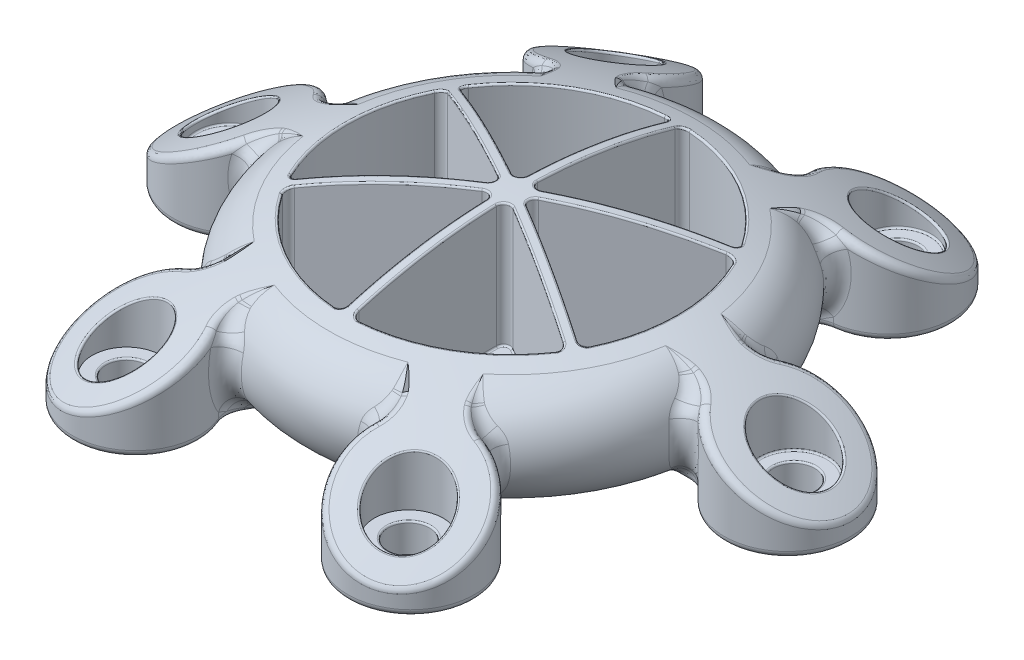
SolidWorks part; units mm, degrees
ref_plane "Front" through (0, 0, 0) normal (0, 0, 1) x (1, 0, 0)
ref_plane "Top" through (0, 0, 0) normal (0, 1, 0) x (1, 0, 0)
ref_plane "Right" through (0, 0, 0) normal (1, 0, 0) x (0, 0, -1)
sketch "Sketch2" plane through (0, 0, 0) normal (0, 0, 1) x (1, 0, 0)
  line L0 (0, 0) -> (0, 53.3463) construction
  line L1 (0, 0) -> (38.1, 0)
  line L2 (0, 31.75) -> (0, 0)
  arc A0 (38.1, 0) -> (42.2745, 24.6943) centre (38.1, 12.7) ccw
  arc A1 (42.2745, 24.6943) -> (0, 31.75) centre (0.5297, -95.2489) ccw
  dimension "D1" = 12.7
  dimension "D2" = 127
  dimension "D3" = 31.75
  dimension "D4" = 50.8
revolve "Revolve1" add sketch "Sketch2" angle 360 about L0
sketch "Sketch3" plane through (0, 0, 0) normal (0, 1, 0) x (1, 0, 0)
  line L0 (0, 0) -> (88.9723, 0) construction
  line L1 (37.5671, 6.35) -> (46.832, 6.35)
  line L2 (37.5671, -6.35) -> (46.832, -6.35)
  arc A0 (37.5671, 6.35) -> (37.5671, -6.35) centre (0, 0) cw
  circle A1 centre (0, 0) radius 38.1 construction
  circle A2 centre (0, 0) radius 42.2745 construction
  arc A3 (46.832, 6.35) -> (51.8829, 8.8515) centre (46.832, 12.7) ccw
  arc A4 (46.832, -6.35) -> (51.8829, -8.8515) centre (46.832, -12.7) cw
  arc A5 (51.8829, 8.8515) -> (51.8829, -8.8515) centre (63.5, 0) cw
  dimension "D3" = 14.605
  dimension "D4" = 6.35
  dimension "D5" = 6.35
  dimension "D1" = 12.7
  dimension "D2" = 63.5
extrude "Extrude1" add sketch "Sketch3" along normal up to surface (22.841 mm away)
sketch "Sketch5" plane through (0, 0, 0) normal (0, 0, 1) x (1, 0, 0)
  line L0 (64.994, -1.016) -> (64.994, 26.0198) construction
  line L2 (64.994, -1.016) -> (64.994, 19.304)
  line L3 (64.994, 19.304) -> (57.0565, 19.304)
  line L4 (57.0565, 19.304) -> (57.0565, 6.604)
  line L5 (57.0565, 6.604) -> (60.2315, 6.604)
  line L6 (60.2315, 6.604) -> (60.2315, -1.016)
  line L7 (60.2315, -1.016) -> (64.994, -1.016)
  line L8 (51.8829, 0) -> (78.105, 0) construction
  dimension "D1" = 20.32
  dimension "D2" = 12.7
  dimension "D3" = 9.525
  dimension "D4" = 15.875
  dimension "D5" = 64.994
  dimension "D6" = 1.016
revolve "Cut-Revolve1" cut sketch "Sketch5" angle 360 about L0
pattern_circular "CirPattern1" count 6 over 360 about axis through (0, 0, 0) along (0, 1, 0) of "Cut-Revolve1", "Extrude1"
ref_plane "Plane1" through (0, 33.02, 0) normal (0, 1, 0) x (-1, 0, 0)
sketch "Sketch6" plane through (0, 33.02, 0) normal (0, 1, 0) x (1, 0, 0)
  line L0 (0, 0) -> (0, 64.5956) construction
  line L1 (0, 0) -> (88.3128, 0) construction
  line L2 (4.6863, 1.3858) -> (32.0919, 17.2084)
  line L3 (4.6863, -1.3858) -> (32.0919, -17.2084)
  arc A0 (37.5671, 6.35) -> (24.2828, 29.3591) centre (0, 0) ccw construction
  arc A2 (34.334, 16.5163) -> (34.334, -16.5163) centre (0, 0) cw
  arc A3 (4.6863, 1.3858) -> (4.6863, -1.3858) centre (5.4864, 0) ccw
  arc A4 (32.0919, -17.2084) -> (34.334, -16.5163) centre (32.892, -15.8226) ccw
  arc A5 (32.0919, 17.2084) -> (34.334, 16.5163) centre (32.892, 15.8226) cw
  point P13 (2.286, 0)
  point P16 (33.5522, -18.0516)
  point P19 (33.5522, 18.0516)
  dimension "D1" = 38.1
  dimension "D4" = 1.6002
  dimension "D5" = 1.6002
  dimension "D2" = 60
  dimension "D3" = 4.572
extrude "Cut-Extrude1" cut sketch "Sketch6" against normal offset from surface (29.845 mm away) 3.175
pattern_circular "CirPattern2" count 6 over 360 about axis through (0, 0, 0) along (0, 1, 0) of "Cut-Extrude1"
fillet "Fillet1" radius 1.5875 60 edges at (-15.4283, 0.7266, -39.4227) (-15.6005, 0, -39.7209) (-18.7546, 0, -46.5032) (-18.6861, 21.908, -45.8946) (-26.599, 0, -33.3709) (-31.4566, 21.3993, -39.8267) (-30.8956, 0, -39.4935) (26.4269, 0.7266, -33.0727) (26.599, 0, -33.3709) (30.8956, 0, -39.4935) (30.4028, 21.908, -39.13) (15.6005, 0, -39.7209) (18.7626, 21.3993, -47.1556) (18.7546, 0, -46.5032) (42.1996, 0, 6.35) (49.6502, 0, 7.0096) (42.1996, 0, -6.35) (49.6502, 0, -7.0096) (15.4283, 0.7266, 39.4227) (15.6005, 0, 39.7209) (18.7546, 0, 46.5032) (18.6861, 21.908, 45.8946) (26.599, 0, 33.3709) (31.4566, 21.3993, 39.8267) (30.8956, 0, 39.4935) (-26.4269, 0.7266, 33.0727) (-26.599, 0, 33.3709) (-30.8956, 0, 39.4935) (-30.4028, 21.908, 39.13) (-15.6005, 0, 39.7209) (-18.7626, 21.3993, 47.1556) (-18.7546, 0, 46.5032) (30.4425, -218.5153, -6.35) (-33.3999, 24.7194, -6.35) (-42.1996, 0, -6.35) (-49.6502, 0, -7.0096) (-49.089, 21.908, -6.7646) (52.6767, -210.8766, 6.35) (-42.1996, 0, 6.35) (-50.2193, 21.3993, 7.3289) (-49.6502, 0, 7.0096) (-39.9876, 5.3311, -67.0528) (-39.0525, 0, -67.6409) (39.3759, 5.308, -67.4486) (39.0525, 0, -67.6409) (78.105, 0, 0) (39.9876, 5.3311, 67.0528) (39.0525, 0, 67.6409) (-39.3759, 5.308, 67.4486) (-39.0525, 0, 67.6409) (-78.1002, 5.308, -0.3749) (-78.105, 0, 0)
fillet "Fillet2" radius 3.175 60 edges at (17.331, 2.8363, 42.7181) (16.1801, 24.0383, 40.7248) (-17.2873, 22.6331, 42.6426) (-28.3295, 2.8363, 36.3681) (-27.1787, 24.0383, 34.3748) (-28.2859, 22.6331, -36.2926) (-17.331, 2.8363, -42.7181) (-16.1801, 24.0383, -40.7248) (17.2873, 22.6331, -42.6426) (28.3295, 2.8363, -36.3681) (27.1787, 24.0383, -34.3748) (28.2859, 22.6331, 36.2926) (29.5207, 22.6406, 6.35) (18.7668, 10.4909, 46.998) (-18.7668, 14.9091, 46.998) (-31.318, 10.4909, 39.7516) (-50.0849, 14.9091, 7.2464) (-50.0849, 10.4909, -7.2464) (-31.318, 14.9091, -39.7516) (-18.7668, 10.4909, -46.998) (18.7668, 14.9091, -46.998) (31.318, 10.4909, -39.7516) (50.0849, 14.9091, -7.2464) (31.318, 14.9091, 39.7516) (50.0849, 10.4909, 7.2464) (15.5511, 0.5873, 38.9259) (-15.5511, 0.5873, 38.9259) (-25.9353, 0.5873, 32.9306) (-41.4864, 0.5873, 5.9953) (-41.4864, 0.5873, -5.9953) (-25.9353, 0.5873, -32.9306) (-15.5511, 0.5873, -38.9259) (15.5511, 0.5873, -38.9259) (25.9353, 0.5873, -32.9306) (41.4864, 0.5873, -5.9953) (25.9353, 0.5873, 32.9306) (41.4864, 0.5873, 5.9953)
fillet "Fillet3" radius 0.381 88 edges at (36.6214, 6.604, 53.9052) (-28.3725, 6.604, 58.6677) (37.4495, 9.1471, 62.4894) (-61.0097, 16.2161, 6.8651) (-64.994, 6.604, 7.9375) (35.4708, 16.7364, -48.927) (25.6229, 6.604, -60.2552) (69.0468, 11.4666, 6.8248) (-28.0666, 18.4671, -49.7004) (-39.3711, 6.604, -52.3177) (-25.5162, 14.0172, 60.0642) (33.1769, 26.2626, 17.3972) (38.1, 26.0667, 0) (33.62, 26.1635, -17.2476) (3.8872, 31.7067, -0.0564) (8.9143, 31.4195, 3.8268) (31.6549, 26.2626, -20.0334) (19.05, 26.0667, -32.9956) (1.8731, 26.1635, -37.7396) (1.8948, 31.7067, -3.3946) (7.7713, 31.4195, -5.8066) (-1.522, 26.2626, -37.4307) (-19.05, 26.0667, -32.9956) (-31.7469, 26.1635, -20.492) (-1.9925, 31.7067, -3.3382) (-1.143, -222.2474, 0) (-33.1769, 26.2626, -17.3972) (-38.1, 26.0667, 0) (-33.62, 26.1635, 17.2476) (-3.8872, 31.7067, 0.0564) (-8.9143, 31.4195, -3.8268) (-31.6549, 26.2626, 20.0334) (-19.05, 26.0667, 32.9956) (-1.8731, 26.1635, 37.7396) (-1.8948, 31.7067, 3.3946) (-7.7713, 31.4195, 5.8066) (1.522, 26.2626, 37.4307) (19.05, 26.0667, 32.9956) (31.7469, 26.1635, 20.492) (1.9925, 31.7067, 3.3382) (1.143, -222.2474, 0) (-18.3891, 3.175, 9.2971) (-33.3639, 3.175, 17.3516) (-38.1, 3.175, 0) (-33.3639, 3.175, -17.3516) (-18.3891, 3.175, -9.2971) (-3.8862, 3.175, 0) (-17.2461, 3.175, -11.2768) (-31.7089, 3.175, -20.2182) (-19.05, 3.175, -32.9956) (-1.655, 3.175, -37.5698) (-1.143, 3.175, -20.574) (-1.9431, 3.175, -3.3655) (1.143, 3.175, -20.574) (1.655, 3.175, -37.5698) (19.05, 3.175, -32.9956) (31.7089, 3.175, -20.2182) (17.2461, 3.175, -11.2768) (1.9431, 3.175, -3.3655) (18.3891, 3.175, -9.2971) (33.3639, 3.175, -17.3516) (38.1, 3.175, 0) (33.3639, 3.175, 17.3516) (18.3891, 3.175, 9.2971) (3.8862, 3.175, 0) (-1.143, 3.175, 20.574) (-1.655, 3.175, 37.5698) (-19.05, 3.175, 32.9956) (-31.7089, 3.175, 20.2182) (-17.2461, 3.175, 11.2768) (-1.9431, 3.175, 3.3655) (17.2461, 3.175, 11.2768) (31.7089, 3.175, 20.2182) (19.05, 3.175, 32.9956) (1.655, 3.175, 37.5698) (1.143, 3.175, 20.574) (1.9431, 3.175, 3.3655) (-64.994, 6.604, 4.7625) (-36.6214, 6.604, -53.9052) (28.3725, 6.604, -58.6677) (64.994, 6.604, -7.9375) (64.994, 6.604, -4.7625)
